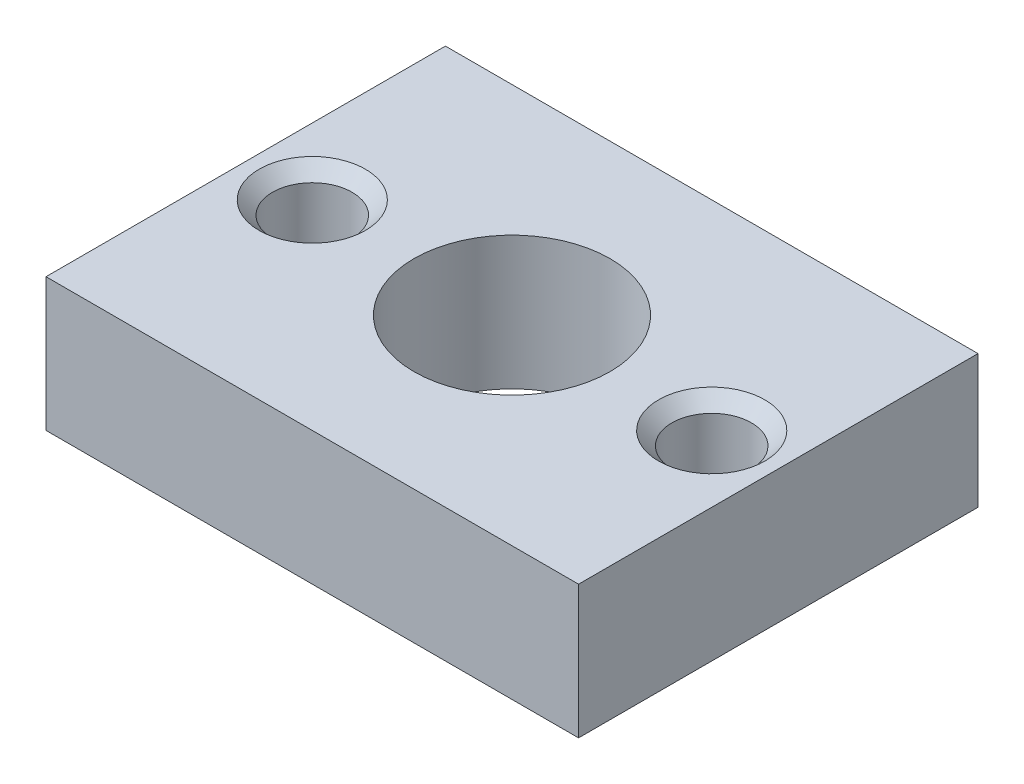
SolidWorks part; units mm, degrees
ref_plane "Front Plane" through (0, 0, 0) normal (0, 0, 1) x (1, 0, 0)
ref_plane "Top Plane" through (0, 0, 0) normal (0, 1, 0) x (1, 0, 0)
ref_plane "Right Plane" through (0, 0, 0) normal (1, 0, 0) x (0, 0, -1)
sketch "Sketch1" plane through (0, 0, 0) normal (0, 1, 0) x (1, 0, 0)
  line L1 (-12.7, -9.525) -> (12.7, -9.525)
  line L2 (-12.7, -9.525) -> (-12.7, 9.525)
  line L3 (-12.7, 9.525) -> (12.7, 9.525)
  line L4 (12.7, -9.525) -> (12.7, 9.525)
  line L5 (-12.7, -9.525) -> (12.7, 9.525) construction
  line L6 (-12.7, 9.525) -> (12.7, -9.525) construction
  point P0 (0, 0)
  dimension "D1" = 25.4
  dimension "D2" = 19.05
extrude "Extrude1" add sketch "Sketch1" along normal blind 6.35
sketch "Sketch2" plane through (0, 6.35, 0) normal (0, 1, 0) x (-1, 0, 0)
  circle A0 centre (0, 0) radius 4.7625 construction
  dimension "D1" = 9.525
sketch "Sketch3" plane through (0, 6.35, 0) normal (0, 1, 0) x (-1, 0, 0)
  line L0 (12.7, -9.525) -> (12.7, 9.525) construction
  line L1 (-12.7, 9.525) -> (-12.7, -9.525) construction
  point P0 (9.525, 0)
  point P1 (-9.525, 0)
  dimension "D1" = 3.175
  dimension "D2" = 3.175
hole_wizard "#6 Clearance Hole1" positions "3DSketch1" profile "Sketch5" hole size "#6" standard "Ansi Inch"
sketch3d "3DSketch1"
  point P1 (-9.525, 6.35, 0)
  point P4 (9.525, 6.35, 0)
sketch "Sketch5" plane through (-9.525, 6.35, 0) normal (1, 0, 0) x (0, 0, 1)
  line L0 (0, 0) -> (0, 6.35)
  line L1 (0, 6.35) -> (1.8986, 6.35)
  line L2 (1.8986, 6.35) -> (1.8986, 0.635)
  line L3 (1.8986, 0.635) -> (2.5337, 0)
  line L5 (2.5337, 0) -> (0, 0)
  line L6 (-1.8986, 0.635) -> (-2.5337, 0) construction
  line L11 (0, -6.35) -> (0, 107.95) construction
  dimension "Thru Hole Dia." = 3.7973
  dimension "Thru Hole Depth" = 6.35
  dimension "Near C'Sink Dia." = 5.0673
  dimension "Near C'Sink Angle" = 90
hole_wizard "U (0.368) Diameter Hole1" positions "3DSketch2" profile "Sketch7" hole size "U" standard "Ansi Inch"
sketch3d "3DSketch2"
  point P0 (0, 6.35, 0)
sketch "Sketch7" plane through (0, 6.35, 0) normal (1, 0, 0) x (0, 0, 1)
  line L0 (0, 0) -> (0, 6.35)
  line L1 (0, 6.35) -> (4.6736, 6.35)
  line L2 (4.6736, 6.35) -> (4.6736, 0)
  line L5 (4.6736, 0) -> (0, 0)
  line L11 (0, -6.35) -> (0, 107.95) construction
  dimension "Thru Hole Dia." = 9.3472
  dimension "Thru Hole Depth" = 6.35
